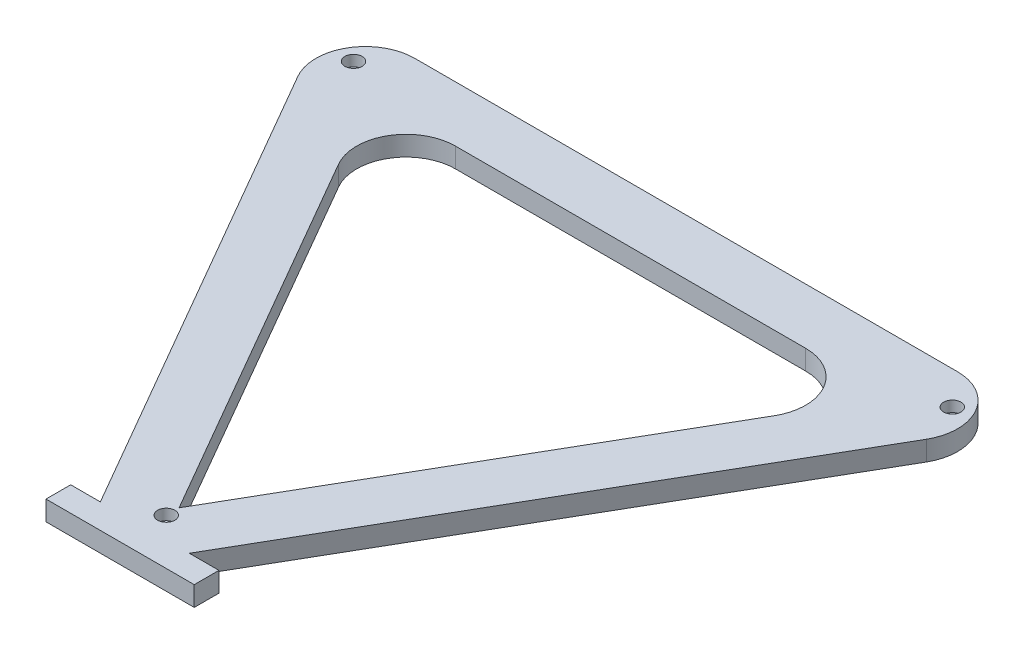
SolidWorks part; units mm, degrees
ref_plane "Front Plane" through (0, 0, 0) normal (0, 0, 1) x (1, 0, 0)
ref_plane "Top Plane" through (0, 0, 0) normal (0, 1, 0) x (1, 0, 0)
ref_plane "Right Plane" through (0, 0, 0) normal (1, 0, 0) x (0, 0, -1)
sketch "Sketch1" plane through (0, 0, 0) normal (0, 1, 0) x (1, 0, 0)
  line L0 (-50.5522, -73.9966) -> (-105.142, 20.5556)
  line L1 (-50.5522, -73.9966) -> (-56.5522, -73.9966)
  line L2 (-56.5522, -78.9966) -> (-56.5522, -73.9966)
  line L3 (-36.5522, -78.9966) -> (-46.5522, -78.9966)
  line L4 (-46.5522, -78.9966) -> (-56.5522, -78.9966)
  line L5 (-26.5522, -78.9966) -> (-36.5522, -78.9966)
  line L6 (-26.5522, -78.9966) -> (-26.5522, -73.9966)
  line L7 (-26.5522, -73.9966) -> (-32.5522, -73.9966)
  line L8 (22.0375, 20.5556) -> (-32.5522, -73.9966)
  line L9 (-96.4817, 35.5556) -> (13.3773, 35.5556)
  line L19 (2.5375, 9.2973) -> (-41.5522, -67.0684)
  line L20 (-76.9817, 24.2973) -> (-6.1227, 24.2973)
  line L21 (-41.5522, -67.0684) -> (-85.642, 9.2973)
  circle A0 centre (-41.5522, -69.6665) radius 1.5
  circle A1 centre (19.0375, 28.8236) radius 1.5775
  circle A2 centre (-102.142, 28.8236) radius 1.5
  arc A3 (-96.4817, 35.5556) -> (-105.142, 30.5556) centre (-96.4817, 25.5556) ccw
  arc A4 (-105.142, 30.5556) -> (-105.142, 20.5556) centre (-96.4817, 25.5556) ccw
  arc A5 (22.0375, 20.5556) -> (22.0375, 30.5556) centre (13.3773, 25.5556) ccw
  arc A6 (22.0375, 30.5556) -> (13.3773, 35.5556) centre (13.3773, 25.5556) ccw
  arc A11 (2.5375, 9.2973) -> (2.5375, 19.2973) centre (-6.1227, 14.2973) ccw
  arc A12 (2.5375, 19.2973) -> (-6.1227, 24.2973) centre (-6.1227, 14.2973) ccw
  arc A13 (-76.9817, 24.2973) -> (-85.642, 19.2973) centre (-76.9817, 14.2973) ccw
  arc A14 (-85.642, 19.2973) -> (-85.642, 9.2973) centre (-76.9817, 14.2973) ccw
  dimension "D1" = 3
  dimension "D2" = 3.155
  dimension "D3" = 10
  dimension "D4" = 13.3773
  dimension "D5" = 19.0375
  dimension "D6" = 22.0375
  dimension "D7" = 26.5522
  dimension "D8" = 32.5522
  dimension "D9" = 36.5522
  dimension "D10" = 41.5522
  dimension "D11" = 20.5556
  dimension "D13" = 28.8236
  dimension "D15" = 102.142
  dimension "D17" = 69.6665
  dimension "D19" = 78.9966
extrude "Boss-Extrude1" add sketch "Sketch1" along normal blind 4 contours L8 L7 L6 L5 L3 L4 L2 L1 L0 A4 A3 L9 A6 A5 | L19 L21 A14 A13 L20 A12 A11
sketch "Sketch2" plane through (0, 4, 0) normal (0, 1, 0) x (1, 0, 0)
  circle A3 centre (-41.5522, -69.6665) radius 1.75
  circle A4 centre (-102.142, 28.8236) radius 1.75
  circle A5 centre (19.0375, 28.8236) radius 1.75
  dimension "D1" = 3.5
extrude "Cut-Extrude1" cut sketch "Sketch2" against normal blind 2.2
